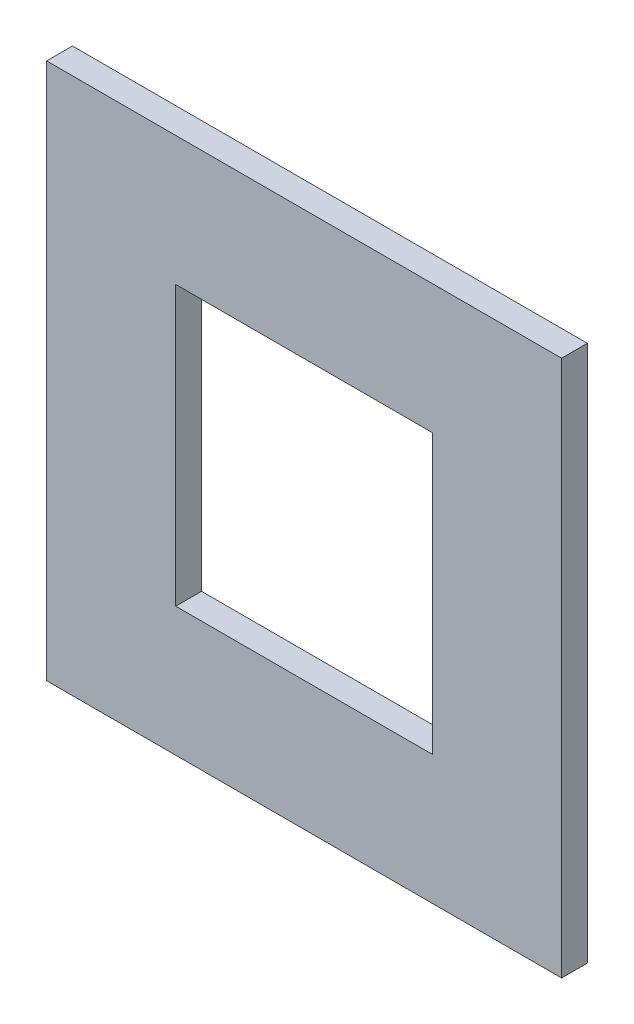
SolidWorks part; units mm, degrees
ref_plane "Front Plane" through (0, 0, 0) normal (0, 0, 1) x (1, 0, 0)
ref_plane "Top Plane" through (0, 0, 0) normal (0, 1, 0) x (1, 0, 0)
ref_plane "Right Plane" through (0, 0, 0) normal (1, 0, 0) x (0, 0, -1)
sketch "Sketch1" plane through (0, 0, 0) normal (0, 0, 1) x (1, 0, 0)
  line L1 (74.6125, -80.9625) -> (-74.6125, -80.9625)
  line L2 (74.6125, -80.9625) -> (74.6125, 80.9625)
  line L3 (74.6125, 80.9625) -> (-74.6125, 80.9625)
  line L4 (-74.6125, -80.9625) -> (-74.6125, 80.9625)
  line L5 (74.6125, -80.9625) -> (-74.6125, 80.9625) construction
  line L6 (74.6125, 80.9625) -> (-74.6125, -80.9625) construction
  line L7 (-639.1231, 371.2771) -> (768.3621, 371.2771)
  line L8 (-639.1231, 371.2771) -> (-639.1231, -757.682)
  line L9 (-639.1231, -757.682) -> (768.3621, -757.682)
  line L10 (768.3621, 371.2771) -> (768.3621, -757.682)
  point P0 (0, 0)
  dimension "D1" = 149.225
  dimension "D2" = 161.925
extrude "Boss-Extrude1" add sketch "Sketch1" along normal blind 15
sketch "Sketch2" plane through (0, 0, 0) normal (0, 0, -1) x (-1, 0, 0)
  line L0 (-74.6125, -80.9625) -> (-74.6125, 80.9625) construction
  line L1 (-834.5725, 454.6118) -> (800.2783, 454.6118)
  line L2 (-834.5725, 454.6118) -> (-834.5725, -959.418)
  line L3 (-834.5725, -959.418) -> (800.2783, -959.418)
  line L4 (800.2783, 454.6118) -> (800.2783, -959.418)
  line L5 (-149.6125, 155.9625) -> (149.6125, 155.9625)
  line L6 (-149.6125, 155.9625) -> (-149.6125, -155.9625)
  line L7 (-149.6125, -155.9625) -> (149.6125, -155.9625)
  line L8 (149.6125, 155.9625) -> (149.6125, -155.9625)
  line L9 (74.6125, 80.9625) -> (74.6125, -80.9625) construction
  line L10 (-74.6125, 80.9625) -> (74.6125, 80.9625) construction
  line L11 (74.6125, -80.9625) -> (-74.6125, -80.9625) construction
  dimension "D1" = 75
  dimension "D2" = 75
  dimension "D3" = 75
  dimension "D4" = 75
extrude "Cut-Extrude1" cut sketch "Sketch2" against normal through all
